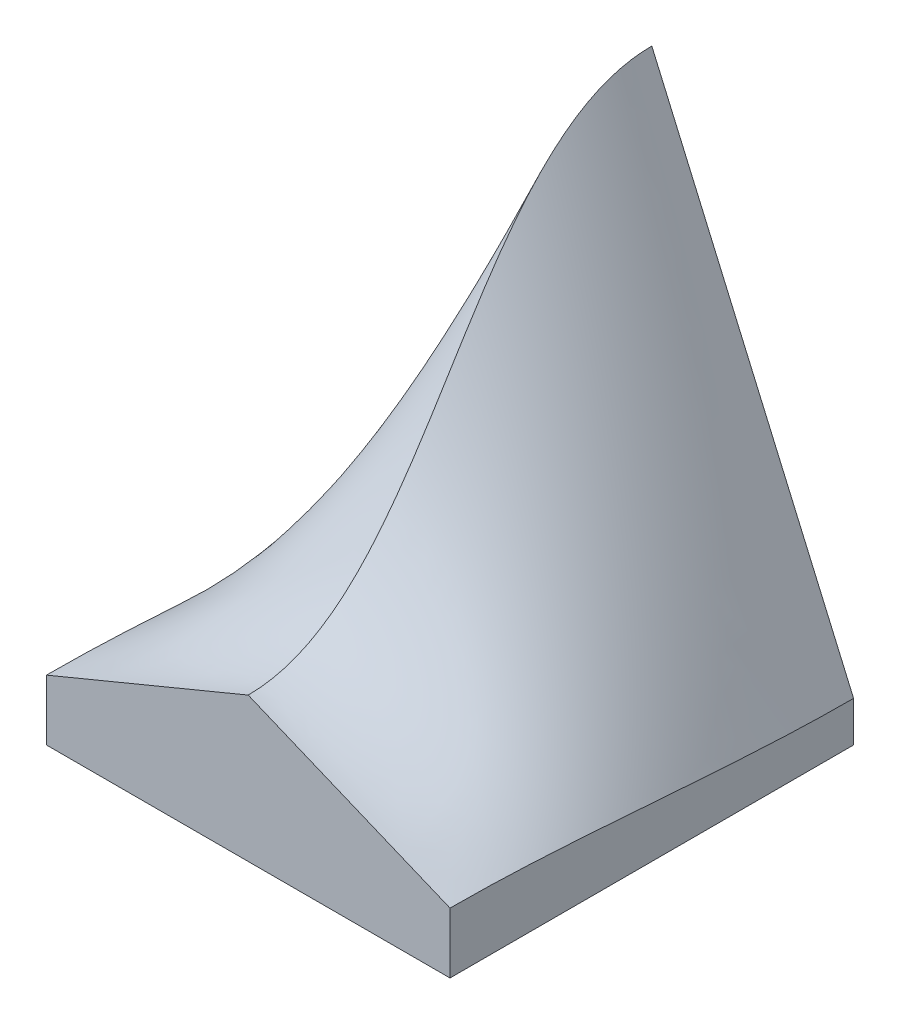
SolidWorks part; units mm, degrees
ref_plane "Front Plane" through (0, 0, 0) normal (0, 0, 1) x (1, 0, 0)
ref_plane "Top Plane" through (0, 0, 0) normal (0, 1, 0) x (1, 0, 0)
ref_plane "Right Plane" through (0, 0, 0) normal (1, 0, 0) x (0, 0, -1)
ref_plane "Plane1" through (0, 0, -50) normal (0, 0, 1) x (1, 0, 0)
sketch "Sketch1" plane through (0, 0, 0) normal (0, 0, -1) x (1, 0, 0)
  line L0 (0, -17.8553) -> (25, -7.5)
  line L1 (-25, -7.5) -> (0, -17.8553)
  line L2 (-25, -7.5) -> (-25, 0)
  line L3 (-25, 0) -> (25, 0)
  line L4 (25, -7.5) -> (25, 0)
  line L5 (0, -17.8553) -> (0, 0) construction
  dimension "D1" = 50
  dimension "D2" = 135
  dimension "D3" = 7.5
sketch "Sketch2" plane through (-1.3114, -2.4692, -50) normal (0, 0, 1) x (1, 0, 0)
  line L0 (1.3114, 64.9653) -> (26.3114, 7.4692)
  line L1 (-23.6886, 7.4692) -> (1.3114, 64.9653)
  line L2 (-23.6886, 7.4692) -> (-23.6886, 2.4692)
  line L3 (-23.6886, 2.4692) -> (26.3114, 2.4692)
  line L4 (26.3114, 7.4692) -> (26.3114, 2.4692)
  line L6 (1.3114, 64.9653) -> (1.3114, 2.4692) construction
  line L8 (-23.6886, 2.4692) -> (26.3114, 2.4692) construction
  line L9 (-23.6886, 9.9692) -> (-23.6886, 2.4692) construction
  dimension "D1" = 50
  dimension "D2" = 5
  dimension "D3" = 47
loft "Loft1" add profiles "Sketch1", "Sketch2"
